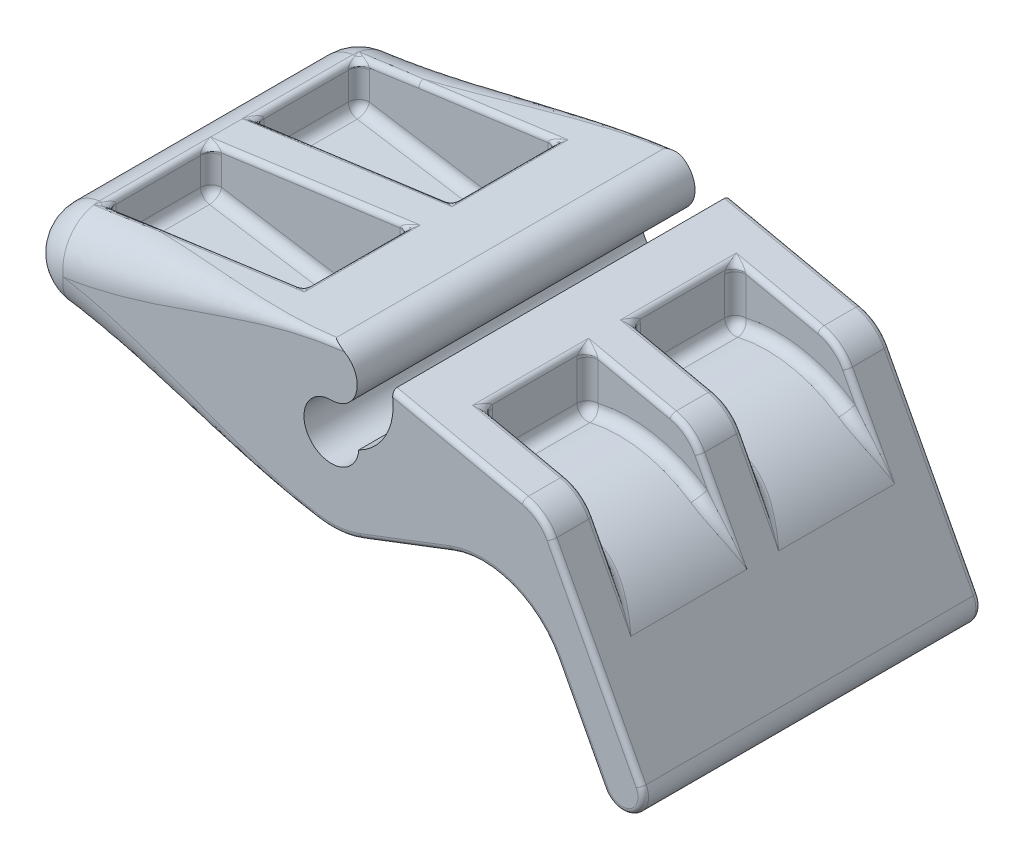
SolidWorks part; units mm, degrees
ref_plane "Front Plane" through (0, 0, 0) normal (0, 0, 1) x (1, 0, 0)
ref_plane "Top Plane" through (0, 0, 0) normal (0, 1, 0) x (1, 0, 0)
ref_plane "Right Plane" through (0, 0, 0) normal (1, 0, 0) x (0, 0, -1)
sketch "Sketch1" plane through (0, 0, 0) normal (0, 0, 1) x (1, 0, 0)
  line L0 (0, 3.75) -> (-12.9702, 1.9817)
  line L1 (-13.015, -1.975) -> (-0.6299, -3.9501)
  line L2 (1.4295, -3.7358) -> (5.6962, -2.1032)
  line L3 (10.6652, -3.9757) -> (12.8885, -8.1991)
  line L4 (0, 0) -> (0, 3.75) construction
  line L5 (2.8619, 3.1293) -> (9.0886, 1.779)
  line L6 (10.4344, 0.7561) -> (14.6583, -7.2675)
  line L7 (12.4349, -3.0441) -> (14.6583, -7.2675) construction
  arc A0 (0, 1.3) -> (1.2964, -0.097) centre (0, 0) ccw
  arc A1 (-12.9702, 1.9817) -> (-13.015, -1.975) centre (-12.7, 0) ccw
  arc A2 (5.6962, -2.1032) -> (10.6652, -3.9757) centre (7.1257, -5.839) cw
  arc A3 (1.4295, -3.7358) -> (-0.6299, -3.9501) centre (0, 0) cw
  arc A4 (0, 1.3) -> (0, 3.75) centre (0, 2.525) ccw
  arc A5 (1.2964, -0.097) -> (2.8619, 3.1293) centre (0, 2.525) ccw
  arc A6 (10.4344, 0.7561) -> (9.0886, 1.779) centre (8.6647, -0.1756) ccw
  arc A7 (0, -0.4) -> (0, 5.45) centre (0, 2.525) ccw construction
  arc A8 (12.8885, -8.1991) -> (14.6583, -7.2675) centre (13.7734, -7.7333) ccw
  point P25 (10, 1.5813)
  dimension "D1" = 2.6
  dimension "D2" = 2
  dimension "D3" = 4
  dimension "D5" = 3.75
  dimension "D6" = 1.7
  dimension "D13" = 4
  dimension "D14" = 2
  dimension "D4" = 12.7
  dimension "D9" = 10
  dimension "D10" = 10
  dimension "D11" = 20
  dimension "D12" = 150
  dimension "D7" = 130
  dimension "D8" = 2
extrude "Boss-Extrude1" add sketch "Sketch1" along normal mid plane 16
sketch "Sketch4" plane through (0, 0, 0) normal (0, 0, 1) x (1, 0, 0)
  line L9 (-12.7, 0) -> (-12.7, 2.0185)
  line L10 (5.13, -0.1807) -> (5.13, 2.6375)
  line L11 (4.9814, -0.2353) -> (0.7148, -1.8679)
  line L12 (-0.315, -1.975) -> (-12.7, 0)
  line L14 (-3.25, -1.507) -> (-12.7, 0)
  line L15 (-3.25, -1.507) -> (-3.25, 3.3069)
  line L16 (0, 3.75) -> (-12.9702, 1.9817) construction
  line L17 (-3.25, 3.3069) -> (-12.7, 2.0185)
  line L18 (9.0886, 1.779) -> (2.8619, 3.1293) construction
  line L19 (14.6583, -7.2675) -> (10.4344, 0.7561) construction
  line L20 (9.0886, 1.779) -> (5.13, 2.6375)
  line L21 (12.4349, -3.0441) -> (10.4344, 0.7561)
  arc A7 (10.4344, 0.7561) -> (9.0886, 1.779) centre (8.6647, -0.1756) ccw construction
  arc A8 (-0.315, -1.975) -> (0.7148, -1.8679) centre (0, 0) ccw
  arc A9 (12.4349, -3.0441) -> (4.9814, -0.2353) centre (7.1257, -5.839) ccw
  arc A11 (12.4349, -3.0441) -> (5.13, -0.1807) centre (7.1257, -5.839) ccw
  arc A12 (10.4344, 0.7561) -> (9.0886, 1.779) centre (8.6647, -0.1756) ccw
  dimension "D2" = 9.45
  dimension "D3" = 8.38
  dimension "D1" = 2
extrude "Cut-Extrude1" cut sketch "Sketch4" against normal mid plane 12
sketch "Sketch5" plane through (0, 0, 0) normal (0, 0, 1) x (1, 0, 0)
  line L3 (5.13, 2.6375) -> (5.13, -0.1807)
  line L4 (-3.25, 3.3069) -> (-12.7, 2.0185)
  line L5 (-3.25, -1.507) -> (-3.25, 3.3069)
  line L6 (-12.7, 0) -> (-3.25, -1.507)
  line L7 (-12.7, 2.0185) -> (-12.7, 0)
  line L8 (-3.25, 3.3069) -> (-12.7, 2.0185)
  line L9 (-3.25, -1.507) -> (-3.25, 3.3069)
  line L10 (-12.7, 0) -> (-3.25, -1.507)
  line L11 (-12.7, 2.0185) -> (-12.7, 0)
  line L12 (9.0886, 1.779) -> (5.13, 2.6375)
  line L13 (12.4349, -3.0441) -> (10.4344, 0.7561)
  line L14 (5.13, 2.6375) -> (5.13, -0.1807)
  line L15 (9.0886, 1.779) -> (5.13, 2.6375)
  line L16 (12.4349, -3.0441) -> (10.4344, 0.7561)
  arc A2 (12.4349, -3.0441) -> (5.13, -0.1807) centre (7.1257, -5.839) ccw
  arc A3 (10.4344, 0.7561) -> (9.0886, 1.779) centre (8.6647, -0.1756) ccw
  arc A4 (12.4349, -3.0441) -> (5.13, -0.1807) centre (7.1257, -5.839) ccw
  arc A5 (10.4344, 0.7561) -> (9.0886, 1.779) centre (8.6647, -0.1756) ccw
  dimension "D1" = 0
  dimension "D2" = 0
extrude "Boss-Extrude2" add sketch "Sketch5" along normal mid plane 2
fillet "VarFillet1" radius 2 3 edges at (-14.6999, 0.0226, 8) (-6.8224, -2.9626, 8) (-6.4851, 2.8658, 8)
fillet "VarFillet3" radius 2 3 edges at (-14.6999, 0.0226, -8) (-6.8224, -2.9626, -8) (-6.4851, 2.8658, -8)
fillet "Fillet4" radius 0.25 22 edges at (7.1093, 2.2082, -1) (9.8749, 1.4167, -1) (7.1093, 2.2082, -6) (9.8749, 1.4167, -6) (7.1093, 2.2082, 1) (9.8749, 1.4167, 1) (7.1093, 2.2082, 6) (9.8749, 1.4167, 6) (-12.7, 2.0185, -3.5) (-12.7, 2.0185, 3.5) (-7.975, 2.6627, 6) (-3.25, 3.3069, 3.5) (-7.975, 2.6627, 1) (-7.975, 2.6627, -6) (-3.25, 3.3069, -3.5) (-7.975, 2.6627, -1) (5.13, 2.6375, -3.5) (11.4347, -1.144, -1) (11.4347, -1.144, -6) (5.13, 2.6375, 3.5) (11.4347, -1.144, 1) (11.4347, -1.144, 6)
fillet "Fillet3" radius 0.5 56 edges at (-12.7, 0.866, -6) (-12.7, 0.866, -1) (-12.7, 0, -3.5) (-3.25, 0.7738, -1) (-7.975, -0.7535, -1) (-7.975, -0.7535, -6) (-3.25, 0.7738, -6) (-3.25, -1.507, -3.5) (-3.25, 0.7738, 1) (-7.975, -0.7535, 1) (-12.7, 0.866, 1) (-12.7, 0, 3.5) (-12.7, 0.866, 6) (-3.25, -1.507, 3.5) (-7.975, -0.7535, 6) (-3.25, 0.7738, 6) (8.4862, 0.0047, -1) (5.13, 1.1005, -1) (8.4862, 0.0047, -6) (5.13, -0.1807, -3.5) (5.13, 1.1005, -6) (8.4862, 0.0047, 1) (5.13, 1.1005, 1) (5.13, -0.1807, 3.5) (5.13, 1.1005, 6) (8.4862, 0.0047, 6) (-12.9223, 1.9683, -6.2199) (-12.7001, 1.7401, -6) (-12.8082, 1.9379, -0.9184) (-12.7006, 1.749, -1) (-3.1883, 3.2531, -0.9144) (-3.25, 3.0717, -0.9994) (-3.1883, 3.2531, -6.0856) (-3.25, 3.0717, -6.0006) (-3.1883, 3.2531, 0.9144) (-3.25, 3.0717, 0.9994) (-12.8082, 1.9379, 0.9184) (-12.7006, 1.749, 1) (-12.9648, 1.9638, 6.2648) (-12.7001, 1.7401, 6) (-3.1883, 3.2531, 6.0856) (-3.25, 3.0717, 6.0006) (11.75, -2.016, -0.9677) (5.0746, 2.5928, -0.9069) (5.13, 2.4089, -0.9986) (11.75, -2.016, -6.0323) (5.0746, 2.5928, -6.0931) (5.13, 2.4089, -6.0014) (11.75, -2.016, 0.9677) (5.0746, 2.5928, 0.9069) (5.13, 2.4089, 0.9986) (5.0746, 2.5928, 6.0931) (5.13, 2.4089, 6.0014) (11.75, -2.016, 6.0323)
